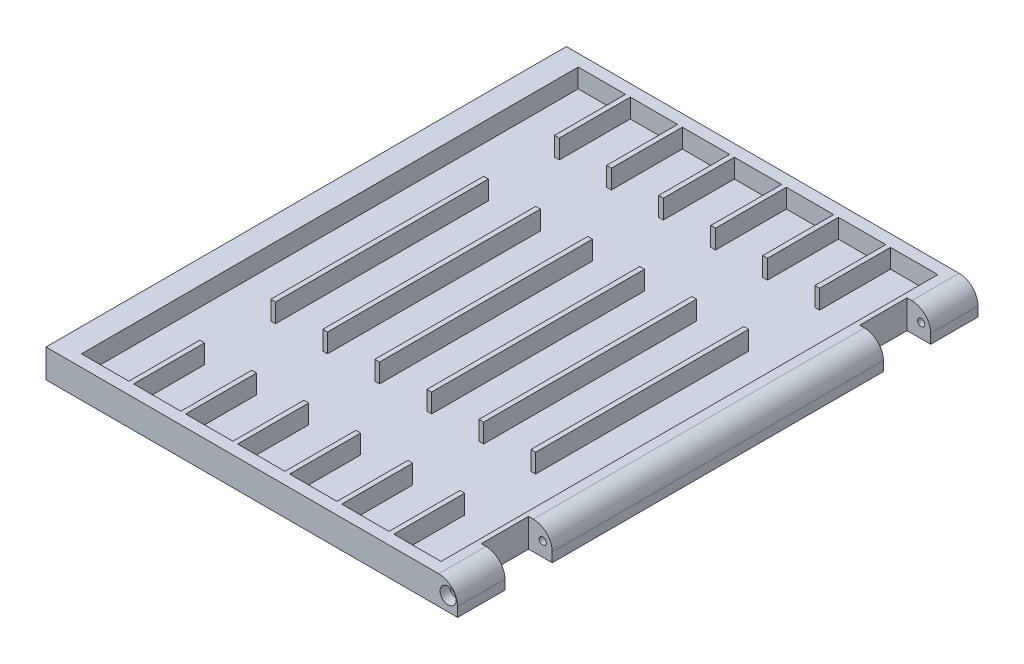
SolidWorks part; units mm, degrees
ref_plane "Спереди" through (0, 0, 0) normal (0, 0, 1) x (1, 0, 0)
ref_plane "Сверху" through (0, 0, 0) normal (0, 1, 0) x (1, 0, 0)
ref_plane "Справа" through (0, 0, 0) normal (1, 0, 0) x (0, 0, -1)
sketch "Эскиз1" plane through (0, 0, 0) normal (0, 1, 0) x (1, 0, 0)
  line L0 (0, 0) -> (0, 110) construction
  line L1 (0, 110) -> (2.502, 110) construction
  line L2 (2.502, 110) -> (2.502, 0) construction
  line L3 (2.502, 0) -> (0, 0) construction
  line L4 (2.502, 0) -> (2.502, 2.502) construction
  line L5 (2.502, 110) -> (2.502, 107.4987) construction
  line L6 (2.502, 107.4987) -> (12.502, 107.4987) construction
  line L7 (12.502, 107.4987) -> (13.5008, 107.4987) construction
  line L8 (78.5041, 107.4987) -> (78.5041, 110) construction
  line L9 (13.5008, 107.4987) -> (23.5008, 107.4987) construction
  line L10 (23.5008, 107.4987) -> (24.504, 107.4987) construction
  line L11 (2.502, 2.502) -> (242.502, 2.502) construction
  line L12 (24.504, 107.4987) -> (34.504, 107.4987) construction
  line L13 (34.504, 107.4987) -> (35.5024, 107.4987) construction
  line L14 (35.5024, 107.4987) -> (45.5024, 107.4987) construction
  line L15 (45.5024, 107.4987) -> (46.502, 107.4987) construction
  line L16 (46.502, 107.4987) -> (56.502, 107.4987) construction
  line L17 (56.502, 107.4987) -> (57.5008, 107.4987) construction
  line L18 (57.5008, 107.4987) -> (67.5008, 107.4987) construction
  line L19 (67.5008, 107.4987) -> (68.5041, 107.4987) construction
  line L20 (68.5041, 107.4987) -> (78.5041, 107.4987) construction
  line L21 (78.5041, 110) -> (81.0004, 110) construction
  line L22 (81.0004, 110) -> (81.0004, 0) construction
  line L23 (81.0004, 0) -> (78.5041, 0) construction
  line L24 (12.502, 107.4987) -> (12.502, 2.502) construction
  line L25 (0, 110) -> (81.0004, 110)
  line L26 (0, 110) -> (0, 0)
  line L27 (0, 0) -> (81.0004, 0)
  line L28 (81.0004, 110) -> (81.0004, 0)
  line L29 (23.5008, 107.4987) -> (23.5008, 2.502) construction
  line L30 (34.504, 107.4987) -> (34.504, 2.502) construction
  line L31 (45.5024, 107.4987) -> (45.5024, 2.502) construction
  line L32 (56.502, 107.4987) -> (56.502, 2.502) construction
  line L33 (67.5008, 107.4987) -> (67.5008, 2.502) construction
  line L34 (78.5041, 107.4987) -> (78.5041, 2.502) construction
  line L36 (2.502, 107.4987) -> (12.502, 107.4987)
  line L37 (2.502, 107.4987) -> (2.502, 2.502)
  line L38 (2.502, 2.502) -> (12.502, 2.502)
  line L39 (12.502, 107.4987) -> (12.502, 2.502)
  line L40 (13.5008, 107.4987) -> (23.5008, 107.4987)
  line L41 (13.5008, 107.4987) -> (13.5008, 2.502)
  line L42 (13.5008, 2.502) -> (23.5008, 2.502)
  line L43 (23.5008, 107.4987) -> (23.5008, 2.502)
  line L44 (24.504, 107.4987) -> (34.504, 107.4987)
  line L45 (24.504, 107.4987) -> (24.504, 2.502)
  line L46 (24.504, 2.502) -> (34.504, 2.502)
  line L47 (34.504, 107.4987) -> (34.504, 2.502)
  line L48 (35.5024, 107.4987) -> (45.5024, 107.4987)
  line L49 (35.5024, 107.4987) -> (35.5024, 2.502)
  line L50 (35.5024, 2.502) -> (45.5024, 2.502)
  line L51 (45.5024, 107.4987) -> (45.5024, 2.502)
  line L52 (46.502, 107.4987) -> (56.502, 107.4987)
  line L53 (46.502, 107.4987) -> (46.502, 2.502)
  line L54 (46.502, 2.502) -> (56.502, 2.502)
  line L55 (56.502, 107.4987) -> (56.502, 2.502)
  line L56 (57.5008, 107.4987) -> (67.5008, 107.4987)
  line L57 (57.5008, 107.4987) -> (57.5008, 2.502)
  line L58 (57.5008, 2.502) -> (67.5008, 2.502)
  line L59 (67.5008, 107.4987) -> (67.5008, 2.502)
  line L60 (68.5041, 107.4987) -> (78.5041, 107.4987)
  line L61 (68.5041, 107.4987) -> (68.5041, 2.502)
  line L62 (68.5041, 2.502) -> (78.5041, 2.502)
  line L63 (78.5041, 107.4987) -> (78.5041, 2.502)
extrude "Бобышка-Вытянуть3" add sketch "Эскиз1" along normal blind 4 and the other way blind 6
sketch "Эскиз5" plane through (0, 4, 0) normal (0, 1, 0) x (1, 0, 0)
  line L1 (0, 0) -> (81.0004, 0)
  line L2 (0, 0) -> (0, 110)
  line L3 (0, 110) -> (81.0004, 110)
  line L4 (81.0004, 0) -> (81.0004, 110)
extrude "Бобышка-Вытянуть4" add sketch "Эскиз5" along normal blind 2 from offset 6
sketch "Эскиз6" plane through (0, 4, 0) normal (0, 1, 0) x (1, 0, 0)
  line L0 (12.502, 2.502) -> (12.502, 17.5051) construction
  line L1 (12.502, 2.502) -> (12.502, 107.4987) construction
  line L2 (12.502, 17.5051) -> (68.5041, 17.5051) construction
  line L3 (68.5041, 107.4987) -> (68.5041, 2.502) construction
  line L4 (68.5041, 17.5051) -> (68.5041, 32.5049) construction
  line L5 (12.502, 107.4987) -> (12.502, 92.4984) construction
  line L6 (12.502, 17.5051) -> (68.5041, 17.5051)
  line L7 (12.502, 17.5051) -> (12.502, 32.5049)
  line L8 (12.502, 32.5049) -> (68.5041, 32.5049)
  line L9 (68.5041, 17.5051) -> (68.5041, 32.5049)
  line L10 (12.502, 92.4984) -> (12.502, 77.4971) construction
  line L11 (12.502, 77.4971) -> (68.5041, 77.4971) construction
  line L13 (12.502, 92.4984) -> (68.5041, 92.4984)
  line L14 (12.502, 92.4984) -> (12.502, 77.4971)
  line L15 (12.502, 77.4971) -> (68.5041, 77.4971)
  line L16 (68.5041, 92.4984) -> (68.5041, 77.4971)
extrude "Вырез-Вытянуть3" cut sketch "Эскиз6" against normal blind 4
sketch "Эскиз7" plane through (0, -6, 0) normal (0, -1, 0) x (1, 0, 0)
  line L0 (81.0004, -110) -> (0, -110) construction
  line L1 (81.0004, 0) -> (0, 0)
  line L2 (81.0004, 0) -> (81.0004, -110)
  line L3 (81.0004, -110) -> (0, -110)
  line L4 (0, 0) -> (0, -110)
extrude "Вырез-Вытянуть4" cut sketch "Эскиз7" against normal blind 4
sketch "Эскиз8" plane through (81.0004, 0, 0) normal (1, 0, 0) x (0, 0, -1)
  line L1 (0, 4) -> (110, 4)
  line L2 (0, 4) -> (0, -2)
  line L3 (0, -2) -> (110, -2)
  line L4 (110, 4) -> (110, -2)
extrude "Бобышка-Вытянуть5" add sketch "Эскиз8" along normal blind 3.5
sketch "Эскиз9" plane through (84.5004, 0, 0) normal (1, 0, 0) x (0, 0, -1)
  line L0 (0, 4) -> (10, 4) construction
  line L1 (110, 4) -> (0, 4) construction
  line L2 (10, 4) -> (10, -2) construction
  line L3 (0, -2) -> (110, -2) construction
  line L4 (10, -2) -> (20, -2) construction
  line L5 (110, 4) -> (100, 4) construction
  line L6 (10, 4) -> (20, 4)
  line L7 (10, 4) -> (10, -2)
  line L8 (10, -2) -> (20, -2)
  line L9 (20, 4) -> (20, -2)
  line L10 (100, 4) -> (90, 4) construction
  line L11 (90, 4) -> (90, -2) construction
  line L13 (90, -2) -> (100, -2)
  line L14 (90, -2) -> (90, 4)
  line L15 (90, 4) -> (100, 4)
  line L16 (100, -2) -> (100, 4)
extrude "Вырез-Вытянуть5" cut sketch "Эскиз9" against normal blind 5
sketch "Эскиз10" plane through (0, 0, -110) normal (0, 0, -1) x (-1, 0, 0)
  line L0 (-84.5004, 4) -> (-84.5004, 1) construction
  line L1 (-84.5004, -2) -> (-84.5004, 4) construction
  line L2 (-84.5004, 1) -> (-82.498, 1) construction
  circle A0 centre (-82.498, 1) radius 0.75
extrude "Вырез-Вытянуть6" cut sketch "Эскиз10" against normal blind 115
sketch "Эскиз11" plane through (0, 0, -110) normal (0, 0, -1) x (-1, 0, 0)
  circle A0 centre (-82.498, 1) radius 1.7
extrude "Вырез-Вытянуть7" cut sketch "Эскиз11" against normal blind 2
sketch "Эскиз12" plane through (0, 0, 0) normal (0, 0, 1) x (1, 0, 0)
  circle A0 centre (82.498, 1) radius 1.7
extrude "Вырез-Вытянуть8" cut sketch "Эскиз12" against normal blind 2
sketch "Эскиз13" plane through (0, 0, 0) normal (-1, 0, 0) x (0, 0, 1)
  line L1 (-110, 4) -> (0, 4)
  line L2 (-110, 4) -> (-110, -2)
  line L3 (-110, -2) -> (0, -2)
  line L4 (0, 4) -> (0, -2)
extrude "Бобышка-Вытянуть7" add sketch "Эскиз13" along normal blind 2.5
sketch "Эскиз15" plane through (-2.5, 0, 0) normal (-1, 0, 0) x (0, 0, 1)
  line L0 (-55, -2) -> (-39.9959, -2) construction
  line L1 (-110, -2) -> (0, -2) construction
  line L2 (-39.9959, -2) -> (-69.9959, -2) construction
  line L3 (-69.9959, -2) -> (-69.9959, 1.0012) construction
  line L5 (-39.9959, -2) -> (-69.9959, -2)
  line L6 (-39.9959, -2) -> (-39.9959, 1.0012)
  line L7 (-39.9959, 1.0012) -> (-69.9959, 1.0012)
  line L8 (-69.9959, -2) -> (-69.9959, 1.0012)
extrude "Вырез-Вытянуть10" cut sketch "Эскиз15" against normal blind 2.5
fillet "Скругление1" radius 4 3 edges at (84.5004, 4, -105) (84.5004, 4, -5) (84.5004, 4, -55)
